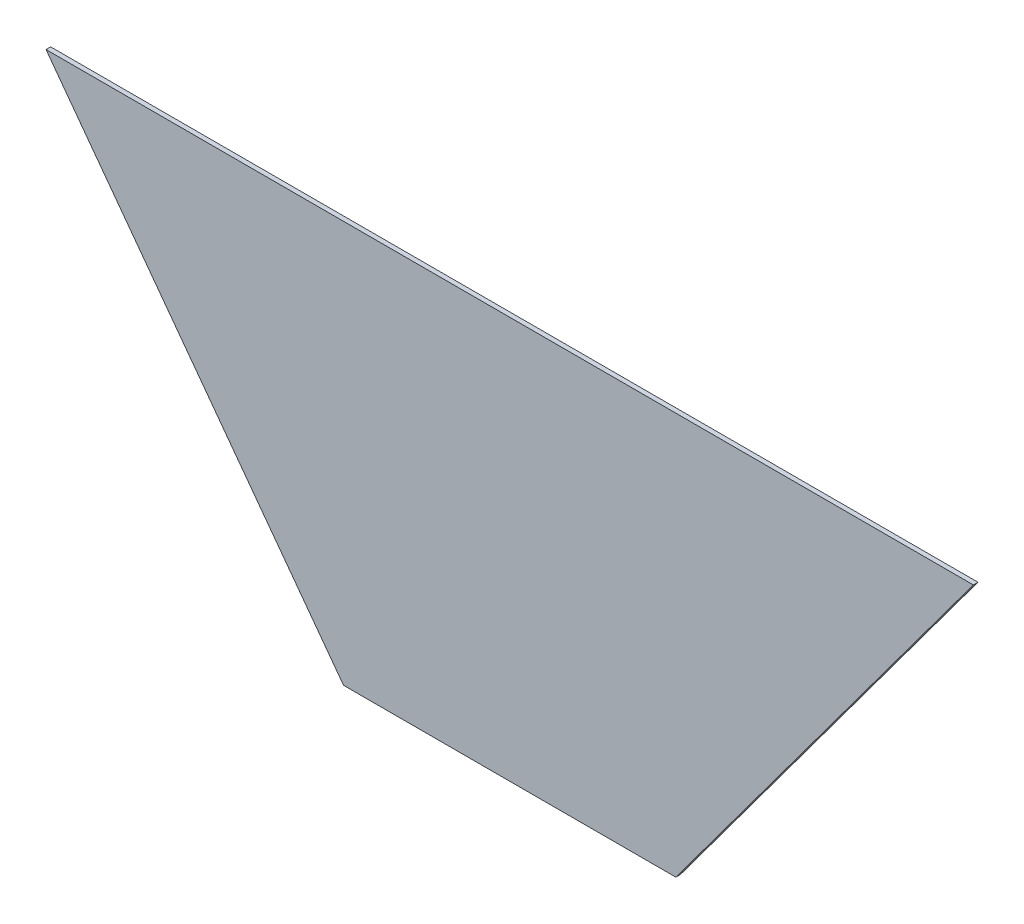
SolidWorks part; units mm, degrees
ref_plane "前视基准面" through (0, 0, 0) normal (0, 0, 1) x (1, 0, 0)
ref_plane "上视基准面" through (0, 0, 0) normal (0, 1, 0) x (1, 0, 0)
ref_plane "右视基准面" through (0, 0, 0) normal (1, 0, 0) x (0, 0, -1)
sketch "草图1" plane through (0, 0, 0) normal (0, 0, 1) x (1, 0, 0)
  line L0 (-107.5, 0) -> (107.5, 0)
  line L1 (0, 0) -> (0, 260) construction
  line L2 (-300, 260) -> (300, 260)
  line L3 (-300, 260) -> (-107.5, 0)
  line L4 (300, 260) -> (107.5, 0)
  dimension "D1" = 215
  dimension "D2" = 260
  dimension "D3" = 600
extrude "凸台-拉伸1" add sketch "草图1" along normal blind 3
